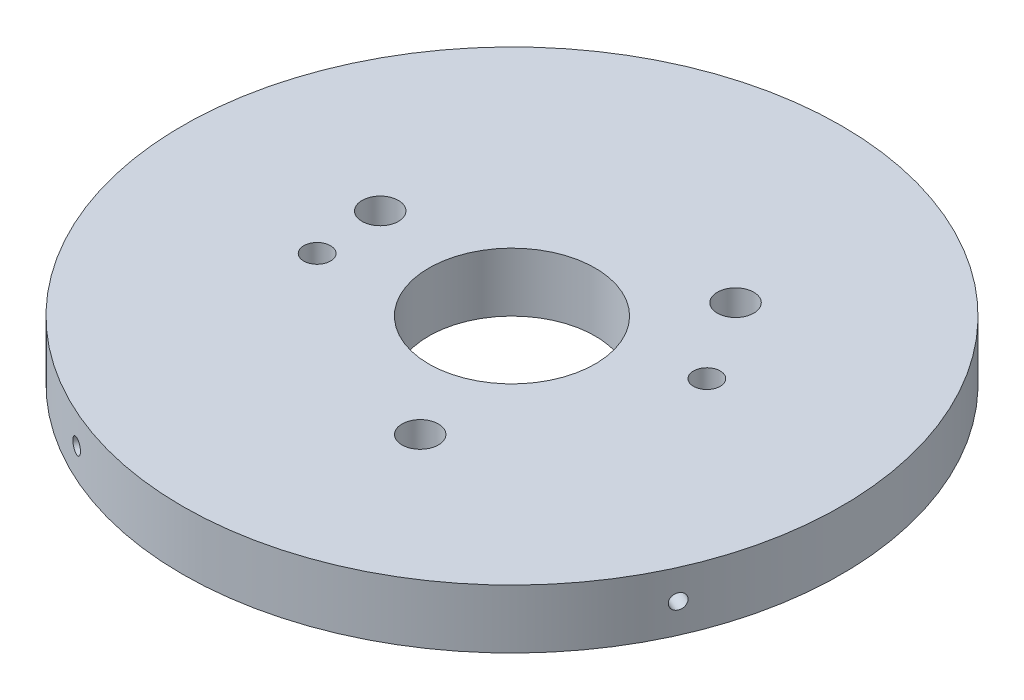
SolidWorks part; units mm, degrees
ref_plane "Front Plane" through (0, 0, 0) normal (0, 0, 1) x (1, 0, 0)
ref_plane "Top Plane" through (0, 0, 0) normal (0, 1, 0) x (1, 0, 0)
ref_plane "Right Plane" through (0, 0, 0) normal (1, 0, 0) x (0, 0, -1)
ref_axis "Axis1" through (0, 6.6675, 0) along (0, -1, 0)
sketch "Sketch1" plane through (0, 0, 0) normal (0, 1, 0) x (1, 0, 0)
  circle A0 centre (0, 0) radius 49.7713
  circle A1 centre (0, 0) radius 12.5603
  dimension "D1" = 99.5426
  dimension "D2" = 25.1206
extrude "Boss-Extrude1" add sketch "Sketch1" along normal blind 8.89
hole_wizard "#8-32 Tapped Hole1" positions "Sketch3" profile "Sketch2" tap size "#8-32" standard "ANSI Inch"
sketch "Sketch3" plane through (0, 6.35, 0) normal (0, 1, 0) x (1, 0, 0)
  circle A0 centre (-26.67, -26.67) radius 2.4574 construction
  circle A1 centre (-26.67, 26.67) radius 2.4574 construction
  circle A2 centre (26.67, 26.67) radius 2.4574 construction
  circle A3 centre (26.67, -26.67) radius 2.4574 construction
  point P0 (-26.67, 26.67)
  point P2 (26.67, 26.67)
  point P4 (-26.67, -26.67)
  point P6 (26.67, -26.67)
sketch "Sketch2" plane through (-26.67, 6.35, -26.67) normal (1, 0, 0) x (0, 0, 1)
  line L0 (0, 0) -> (0, 6.35)
  line L1 (0, 6.35) -> (2.0828, 6.35)
  line L2 (2.0828, 6.35) -> (2.0828, 0)
  line L5 (2.0828, 0) -> (0, 0)
  line L11 (0, -6.35) -> (0, 107.95) construction
  dimension "Thread Major Dia." = 4.1656
  dimension "Thru Tap Drill Depth" = 6.35
hole_wizard "CBORE for M5 Hex Head Bolt1" positions "Sketch5" profile "Sketch4" counterbore size "M5" standard "ANSI Metric"
sketch "Sketch5" plane through (0, 0, 0) normal (0, -1, 0) x (-1, 0, 0)
  circle A0 centre (-15.1383, 18.6234) radius 2.1 construction
  circle A1 centre (-8.5592, -22.4219) radius 2.1 construction
  circle A2 centre (23.6975, 3.7984) radius 2.1 construction
  point P0 (-15.1383, 18.6234)
  point P2 (-8.5592, -22.4219)
  point P4 (23.6975, 3.7984)
sketch "Sketch4" plane through (15.1383, 0, -18.6234) normal (1, 0, 0) x (0, 0, -1)
  line L0 (0, 0) -> (0, 8.89)
  line L1 (0, 8.89) -> (2.75, 8.89)
  line L3 (2.75, 8.89) -> (2.75, 3.58)
  line L4 (2.75, 3.58) -> (6.12, 3.58)
  line L5 (6.12, 3.58) -> (6.12, 0)
  line L7 (6.12, 0) -> (0, 0)
  line L11 (0, -6.35) -> (0, 107.95) construction
  dimension "Thru Hole Dia." = 5.5
  dimension "Thru Hole Depth" = 8.89
  dimension "C'Bore Dia." = 12.24
  dimension "C'Bore Depth" = 3.58
ref_plane "Plane1" through (-20.3311, 0, 45.4294) normal (-0.4085, 0, 0.9128) x (0, -1, 0)
hole_wizard "#4-40 Tapped Hole1" positions "Sketch7" profile "Sketch6" tap size "#4-40" standard "ANSI Inch"
sketch "Sketch7" plane through (-20.3311, 0, 45.4294) normal (-0.4085, 0, 0.9128) x (0, -1, 0)
  line L0 (0, 0) -> (-8.89, 0) construction
  line L1 (-8.89, 49.7713) -> (-8.89, -49.7713) construction
  point P3 (-4.445, 0)
sketch "Sketch6" plane through (-20.3311, 4.445, 45.4294) normal (0, 1, 0) x (0.9128, 0, 0.4085)
  line L0 (0, 0) -> (0, 10.8392)
  line L1 (0, 10.8392) -> (1.1303, 10.16)
  line L2 (1.1303, 10.16) -> (1.1303, 0)
  line L5 (1.1303, 0) -> (0, 0)
  line L10 (0, 10.8392) -> (-1.1303, 10.16) construction
  line L11 (0, -6.35) -> (0, 107.95) construction
  dimension "Tap Drill Dia." = 2.2606
  dimension "Tap Drill Depth" = 10.16
  dimension "Drill Angle" = 118
pattern_circular "CirPattern1" count 4 over 360 about axis through (0, 6.6675, 0) along (0, -1, 0) of "#4-40 Tapped Hole1"
hole_wizard "#10-32 Tapped Hole1" positions "Sketch8" profile "Sketch9" tap size "#10-32" standard "ANSI Inch"
sketch "Sketch8" plane through (0, 0, 0) normal (0, -1, 0) x (-1, 0, 0)
  line L10 (22.9052, -6.522) -> (-22.9052, 6.522) construction
  line L13 (23.6975, 3.7984) -> (0, 0) construction
  circle A1 centre (0, 0) radius 23.8156 construction
  circle A2 centre (0, 0) radius 12.5603 construction
  point P105 (22.9052, -6.522)
  point P108 (-22.9052, 6.522)
  point P112 (-21.7299, 9.7466)
  dimension "D1" = 47.6313
  dimension "D2" = 25
sketch "Sketch9" plane through (-22.9052, 0, 6.522) normal (1, 0, 0) x (0, 0, -1)
  line L0 (0, 0) -> (0, 8.89)
  line L1 (0, 8.89) -> (2.0193, 8.89)
  line L2 (2.0193, 8.89) -> (2.0193, 0)
  line L5 (2.0193, 0) -> (0, 0)
  line L11 (0, -6.35) -> (0, 107.95) construction
  dimension "Thru Tap Drill Dia." = 4.0386
  dimension "Thru Tap Drill Depth" = 8.89
